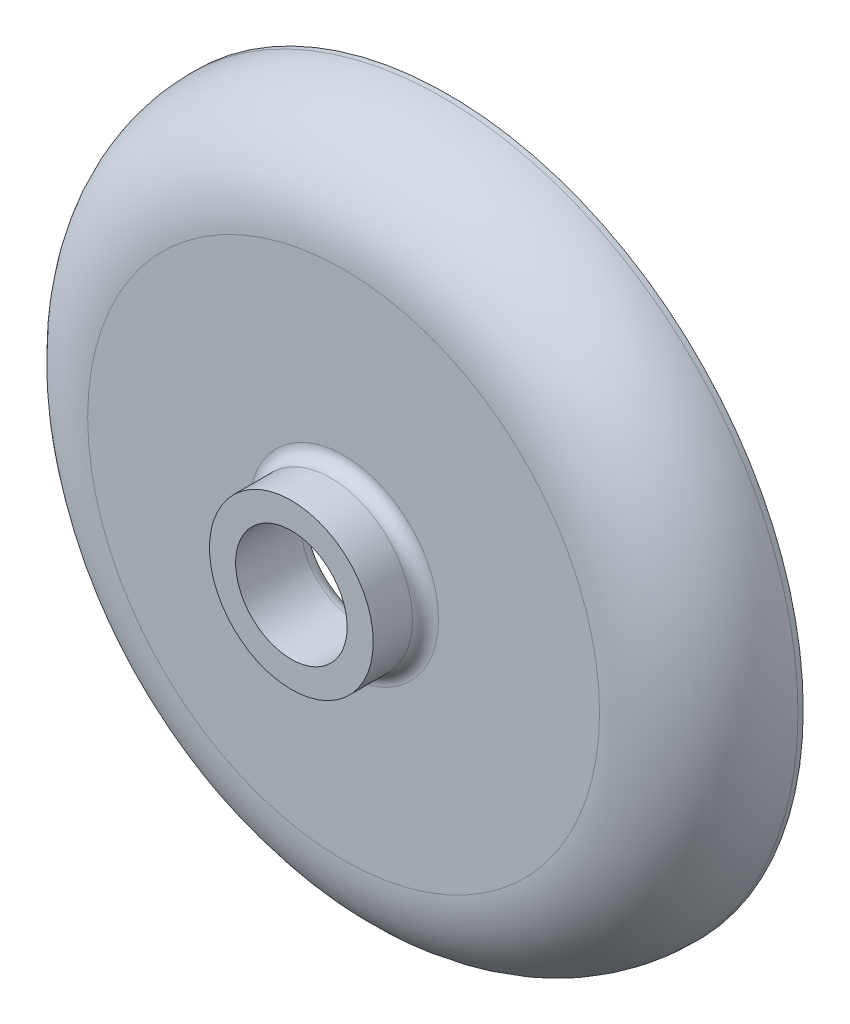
SolidWorks part; units mm, degrees
ref_plane "Plane1" through (0, 0, 0) normal (0, 0, 1) x (1, 0, 0)
ref_plane "Plane2" through (0, 0, 0) normal (0, 1, 0) x (1, 0, 0)
ref_plane "Plane3" through (0, 0, 0) normal (1, 0, 0) x (0, 0, -1)
sketch "Sketch1" plane through (0, 0, 0) normal (0, 0, 1) x (1, 0, 0)
  circle A0 centre (0, 0) radius 13.6
  dimension "D1" = 27.2
extrude "drive shaft plate shape" add sketch "Sketch1" along normal blind 4
fillet "plate main fillet" radius 3.8 1 edges at (13.6, 0, 4)
sketch "Sketch2" plane through (0, 0, 4) normal (0, 0, 1) x (1, 0, 0)
  circle A0 centre (0, 0) radius 3.135
  dimension "D1" = 6.27
extrude "plate boss" add sketch "Sketch2" along normal blind 2
shell "plate shell" thickness 1
sketch "Sketch3" plane through (0, 0, 6) normal (0, 0, 1) x (1, 0, 0)
  circle A0 centre (0, 0) radius 2.135
  dimension "D1" = 4.27
extrude "drive plate hole" cut sketch "Sketch3" against normal up to next
fillet "drive plate secondary fillet" radius 0.5 2 edges at (2.135, 0, 3) (3.135, 0, 4)
equation "\"result\"= 0.001962"
equation "\"result\"= 2*2"
equation "\"result\"= 1*2"
equation "\"result\"= 1.000000*3.280000"
